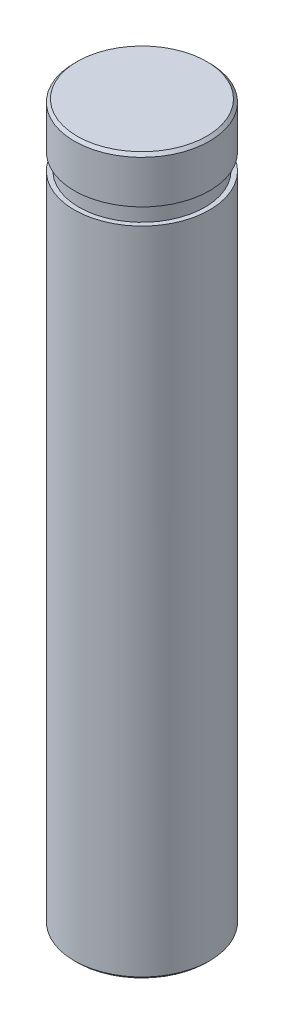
SolidWorks part; units mm, degrees
ref_plane "Front Plane" through (0, 0, 0) normal (0, 0, 1) x (1, 0, 0)
ref_plane "Top Plane" through (0, 0, 0) normal (0, 1, 0) x (1, 0, 0)
ref_plane "Right Plane" through (0, 0, 0) normal (1, 0, 0) x (0, 0, -1)
sketch "Sketch1" plane through (0, 0, 0) normal (0, 0, 1) x (1, 0, 0)
  line L0 (0, 0) -> (0, -52.0183) construction
  line L1 (0, 0) -> (-3, 0)
  line L2 (-3, 0) -> (-3, 28.9814)
  line L3 (-3, 28.9814) -> (-2.794, 28.9814)
  line L4 (-2.794, 28.9814) -> (-2.794, 29.718)
  line L5 (-2.794, 29.718) -> (-3, 29.718)
  line L6 (-3, 29.718) -> (-3, 31.75)
  line L7 (-3, 31.75) -> (0, 31.75)
  line L8 (0, 31.75) -> (0, 0)
  dimension "D1" = 6
  dimension "D2" = 0.7366
  dimension "D3" = 31.75
  dimension "D4" = 5.588
  dimension "D5" = 2.032
revolve "Revolve1" add sketch "Sketch1" angle 360 about L0
chamfer "Chamfer1" distance 0.127 angle 45 2 edges at (0, 0, 3) (0, 31.75, 3)
